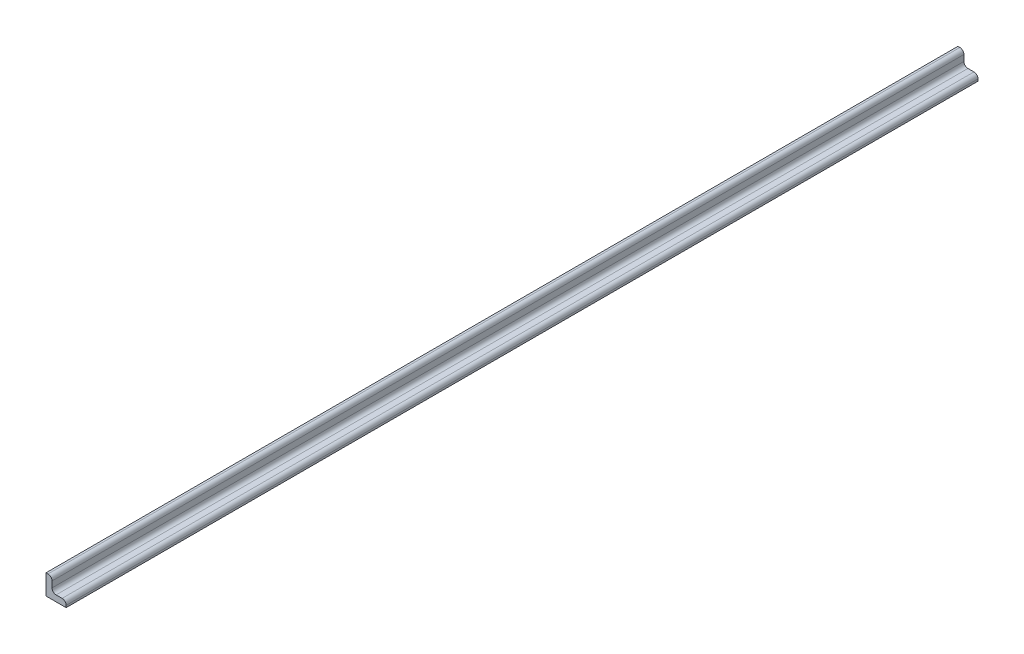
SolidWorks part; units mm, degrees
ref_plane "Plan1" through (0, 0, 0) normal (0, 0, 1) x (1, 0, 0)
ref_plane "Plan2" through (0, 0, 0) normal (0, 1, 0) x (1, 0, 0)
ref_plane "Plan3" through (0, 0, 0) normal (1, 0, 0) x (0, 0, -1)
sketch "Esquisse1" plane through (0, 0, 0) normal (0, 0, 1) x (1, 0, 0)
  line L0 (0, 10) -> (0, 0)
  line L1 (0, 0) -> (10, 0)
  line L2 (0, 10) -> (1, 10)
  line L3 (3, 8) -> (3, 5)
  line L4 (5, 3) -> (8, 3)
  line L5 (10, 1) -> (10, 0)
  arc A0 (5, 3) -> (3, 5) centre (5, 5) cw
  arc A1 (3, 8) -> (1, 10) centre (1, 8) ccw
  arc A2 (10, 1) -> (8, 3) centre (8, 1) ccw
  dimension "D4" = 2
  dimension "D1" = 10
  dimension "D2" = 3
  dimension "D3" = 3
extrude "Base-Extrusion" add sketch "Esquisse1" along normal blind 453
ref_plane "Plan4" through (0, 0, 0) normal (0.7071, 0.7071, 0) x (-0.7071, 0.7071, 0)
ref_plane "Plan5" through (2.8284, 2.8284, 0) normal (0.7071, 0.7071, 0) x (-0.7071, 0.7071, 0)
